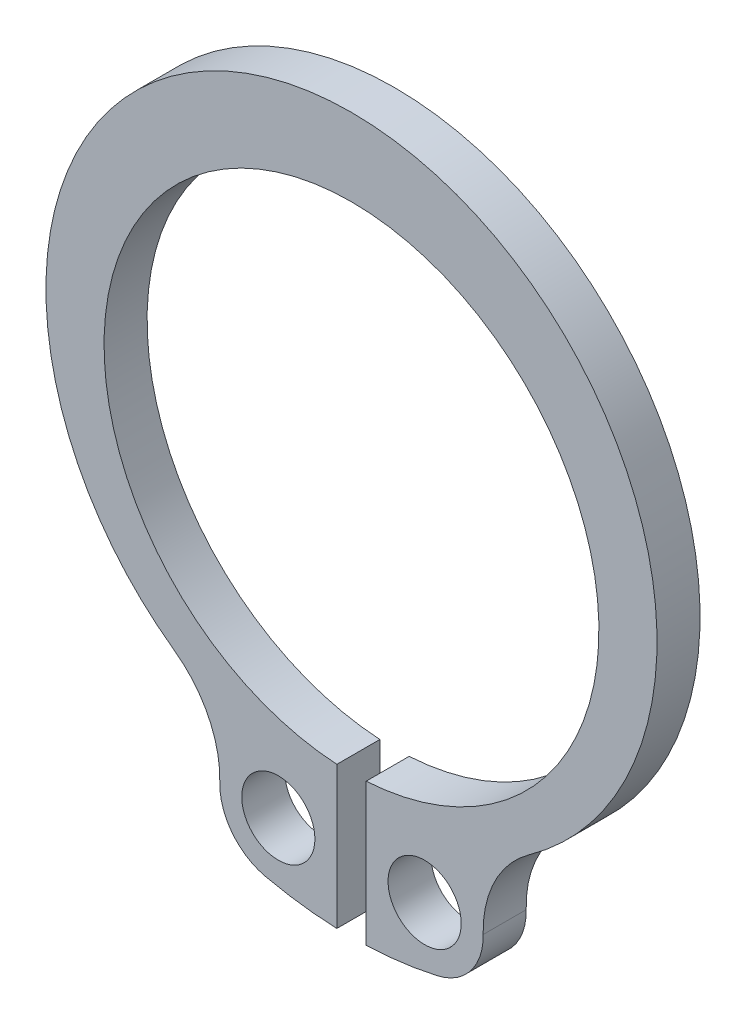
SolidWorks part; units mm, degrees
ref_plane "Face" through (0, 0, 0) normal (0, 0, 1) x (1, 0, 0)
ref_plane "Dessus" through (0, 0, 0) normal (0, 1, 0) x (1, 0, 0)
ref_plane "Droite" through (0, 0, 0) normal (1, 0, 0) x (0, 0, -1)
sketch "Esquisse1" plane through (0, 0, 0) normal (0, 0, 1) x (1, 0, 0)
  line L0 (0.34, -5.7399) -> (0.34, -9.0439)
  line L1 (-0.34, -5.7399) -> (-0.34, -9.0439)
  arc A0 (4.1267, -5.3276) -> (3.0596, -7.4661) centre (5.6088, -7.4026) ccw
  arc A1 (4.1267, -5.3276) -> (-4.1267, -5.3276) centre (0, 0.45) ccw
  arc A2 (2.0006, -8.8264) -> (3.0596, -7.4661) centre (1.7, -7.5) ccw
  arc A3 (-3.0596, -7.4661) -> (-4.1267, -5.3276) centre (-5.6088, -7.4026) ccw
  arc A4 (-3.0596, -7.4661) -> (-2.0006, -8.8264) centre (-1.7, -7.5) ccw
  arc A5 (0.34, -9.0439) -> (2.0006, -8.8264) centre (0, 0) ccw
  arc A6 (-2.0006, -8.8264) -> (-0.34, -9.0439) centre (0, 0) ccw
  circle A7 centre (1.7, -7.5) radius 0.85
  circle A8 centre (-1.7, -7.5) radius 0.85
  arc A9 (0.34, -5.7399) -> (-0.34, -5.7399) centre (0, 0) ccw
  circle A10 centre (0, 0.45) radius 9.5 construction
  dimension "D1" = 11.5
  dimension "D2" = 7.1
  dimension "D3" = 2.55
  dimension "D4" = 0.45
  dimension "D7" = 7.5
  dimension "D8" = 1.7
  dimension "D10" = 3.4
  dimension "D11" = 1.36
  dimension "D12" = 18.9999
  dimension "D5" = 0.34
  dimension "D6" = 0.68
  dimension "D9" = 1.7
extrude "Extrusion1" add sketch "Esquisse1" along normal blind 1
equation "\"D5@Esquisse1\" = \"D6@Esquisse1\"/2"
equation "\"D9@Esquisse1\" = \"D10@Esquisse1\"/2"
